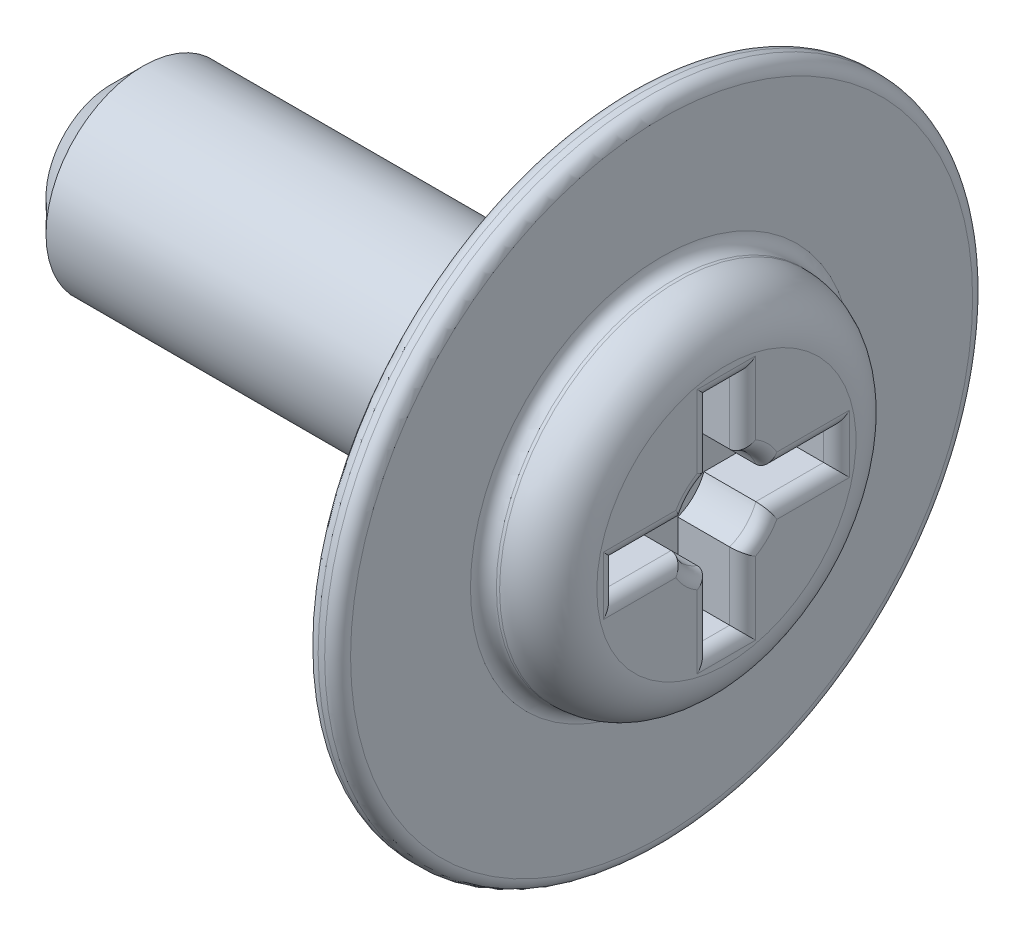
SolidWorks part; units mm, degrees
ref_plane "Face" through (0, 0, 0) normal (0, 0, 1) x (1, 0, 0)
ref_plane "Dessus" through (0, 0, 0) normal (0, 1, 0) x (1, 0, 0)
ref_plane "Droite" through (0, 0, 0) normal (1, 0, 0) x (0, 0, -1)
sketch "Esquisse1" plane through (0, 0, 0) normal (0, 0, 1) x (1, 0, 0)
  line L0 (0, 0) -> (66.1755, 0) construction
  line L1 (0, 0) -> (0, 1.5)
  line L2 (0, 1.5) -> (8, 1.5)
  line L3 (8, 1.5) -> (8, 5)
  line L4 (8, 5) -> (8.5, 5)
  line L5 (8.5, 5) -> (8.5, 2.75)
  line L6 (8.5, 2.75) -> (8.75, 2.75)
  line L7 (9.5, 2) -> (9.5, 0)
  line L8 (0, 0) -> (9.5, 0)
  arc A0 (8.75, 2.75) -> (9.5, 2) centre (8.75, 2) cw
  point P12 (9.5, 2.75)
  dimension "D7" = 0.75
  dimension "D1" = 1.5
  dimension "D2" = 8
  dimension "D3" = 5
  dimension "D4" = 1
  dimension "D5" = 0.5
  dimension "D6" = 5.5
revolve "Révolution1" add sketch "Esquisse1" angle 360 about L0
sketch "Esquisse2" plane through (9.5, 0, 0) normal (1, 0, 0) x (0, 0, -1)
  line L0 (0, 0) -> (0, 2.4613) construction
  line L1 (0.25, 0) -> (-0.25, 0)
  line L2 (-0.25, 0) -> (-0.25, 1.7)
  line L3 (0.25, 0) -> (0.25, 1.7)
  line L4 (-0.25, 1.7) -> (0.25, 1.7)
  point P8 (0, 1.7)
  dimension "D1" = 0.5
  dimension "D2" = 1.7
extrude "Enlèv. mat.-Extru.1" cut sketch "Esquisse2" against normal blind 1
pattern_circular "Répétition circulaire1" count 4 over 360 about axis through (0, 0, 0) along (1, 0, 0)
sketch "Esquisse3" plane through (9.5, 0, 0) normal (1, 0, 0) x (0, 0, -1)
  circle A0 centre (0, 0) radius 0.6998
extrude "Enlèv. mat.-Extru.2" cut sketch "Esquisse3" against normal up to surface (1 mm away)
chamfer "Chanfrein1" distance 0.5 angle 45
fillet "Congé1" radius 0.2
